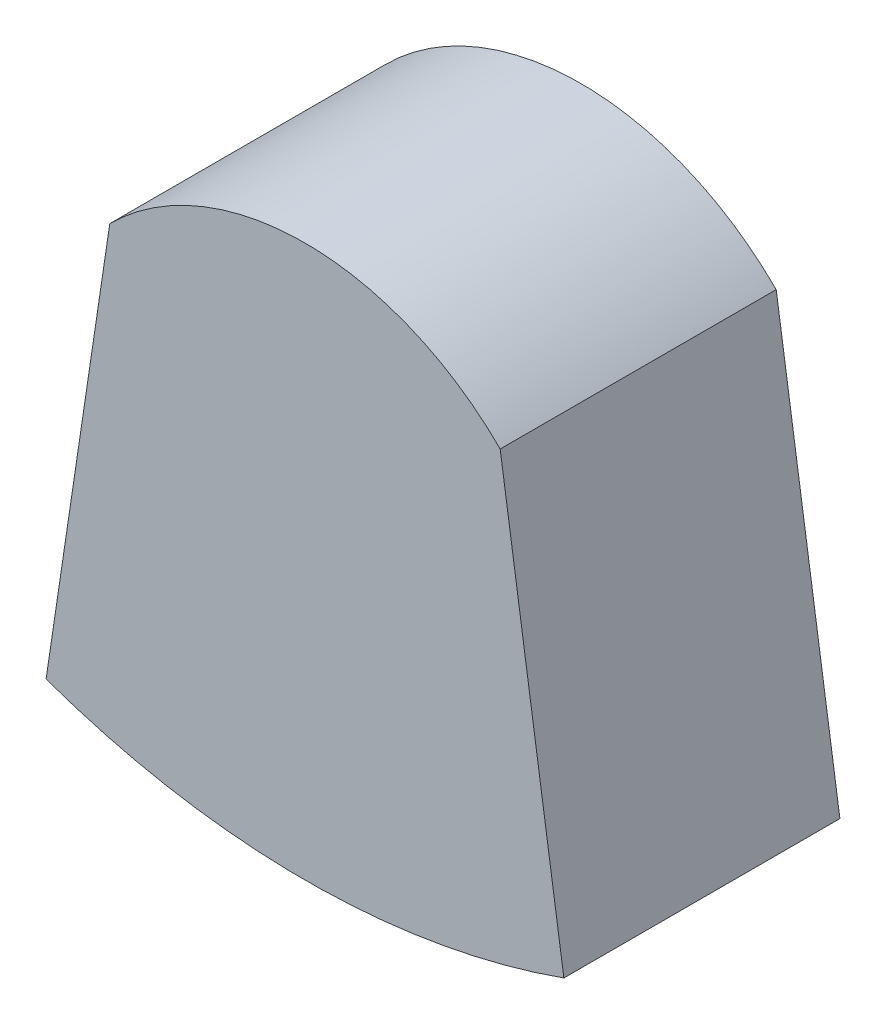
SolidWorks part; units mm, degrees
ref_plane "Front" through (0, 0, 0) normal (0, 0, 1) x (1, 0, 0)
ref_plane "Top" through (0, 0, 0) normal (0, 1, 0) x (1, 0, 0)
ref_plane "Right" through (0, 0, 0) normal (1, 0, 0) x (0, 0, -1)
sketch "Sketch Knob" plane through (0, 0, 0) normal (0, 0, 1) x (1, 0, 0)
  line L0 (-1.7961, -0.1194) -> (-2.3822, -4.0418)
  line L1 (0, 4.5565) -> (0, -8.28) construction
  line L2 (1.7961, -0.1194) -> (2.3822, -4.0418)
  arc A2 (-2.3822, -4.0418) -> (2.3822, -4.0418) centre (0, 2.6594) ccw
  arc A3 (-1.7961, -0.1194) -> (1.7961, -0.1194) centre (0, -1.9154) cw
  dimension "D1" = 7.112
  dimension "D2" = 2.54
  dimension "D3" = 1.7961
  dimension "D4" = 2.3822
  dimension "D5" = 2.6594
  dimension "D6" = 0.1194
extrude "Boss-Extrude Knob" add sketch "Sketch Knob" along normal blind 2.54
